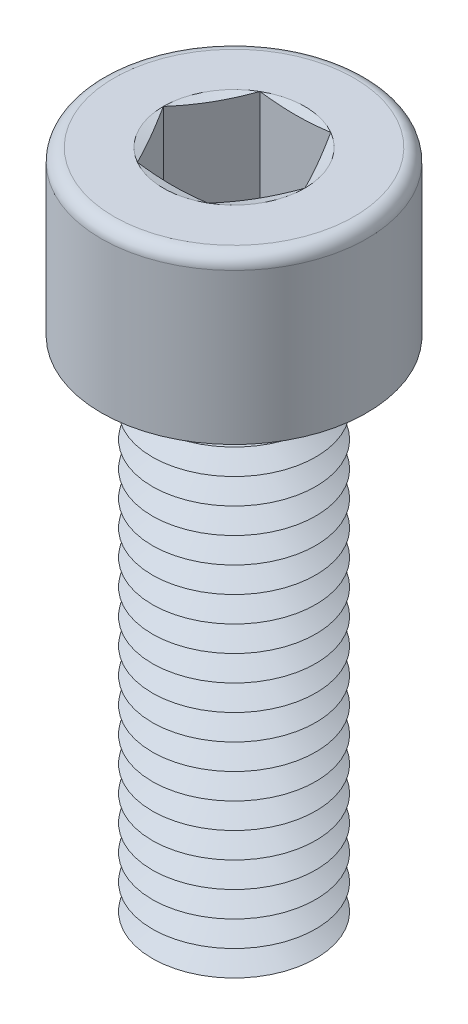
SolidWorks part; units mm, degrees
ref_plane "Front Plane" through (0, 0, 0) normal (0, 0, 1) x (1, 0, 0)
ref_plane "Top Plane" through (0, 0, 0) normal (0, 1, 0) x (1, 0, 0)
ref_plane "Right Plane" through (0, 0, 0) normal (1, 0, 0) x (0, 0, -1)
sketch "Sketch1" plane through (0, 0, 0) normal (0, 1, 0) x (1, 0, 0)
  circle A0 centre (0, 0) radius 4
  dimension "D1" = 8
extrude "Extrude1" add sketch "Sketch1" along normal blind 25
sketch "Sketch2" plane through (0, 25, 0) normal (0, 1, 0) x (1, 0, 0)
  circle A0 centre (0, 0) radius 6.5
  dimension "D1" = 13
extrude "Extrude2" add sketch "Sketch2" along normal blind 8
sketch "Sketch3" plane through (0, 33, 0) normal (0, 1, 0) x (1, 0, 0)
  line L1 (1.7321, 3) -> (-1.7321, 3)
  line L2 (-1.7321, 3) -> (-3.4641, 0)
  line L3 (-3.4641, 0) -> (-1.7321, -3)
  line L4 (-1.7321, -3) -> (1.7321, -3)
  line L5 (1.7321, -3) -> (3.4641, 0)
  line L6 (3.4641, 0) -> (1.7321, 3)
  circle A0 centre (0, 0) radius 3 construction
  dimension "D1" = 6
extrude "Extrude3" cut sketch "Sketch3" against normal blind 6
fillet "Fillet1" radius 0.625 1 edges at (0, 33, 6.5)
sketch "Sketch4" plane through (0, 0, 0) normal (1, 0, 0) x (0, 0, -1)
  line L0 (-3, 27) -> (0, 27)
  line L1 (0, 27) -> (0, 25.2679)
  line L2 (0, 25.2679) -> (-3, 27)
  dimension "D1" = 30
revolve "Cut-Revolve1" cut sketch "Sketch4" angle 360 about L1
sketch "Sketch5" plane through (0, 0, 0) normal (0, 0, 1) x (1, 0, 0)
  line L0 (-4, 0.625) -> (-4, -0.625)
  line L1 (-4, 25) -> (-4, 0) construction
  line L2 (-4, -0.625) -> (-2.9175, 0)
  line L3 (-4, 0) -> (4, 0) construction
  line L4 (-2.9175, 0) -> (-4, 0.625)
  dimension "D1" = 1.25
revolve "Cut-Revolve2" cut sketch "Sketch5" angle 360 about axis through (0, 25, 0) along (0, -1, 0)
pattern_linear "LPattern1" count 20 spacing 1.25 along (0, 1, 0) of "Cut-Revolve2"
sketch "Sketch6" plane through (0, 33, 0) normal (0, 1, 0) x (1, 0, 0)
  circle A0 centre (0, 0) radius 3.4641
extrude "Extrude4" cut sketch "Sketch6" against normal through all draft 75
